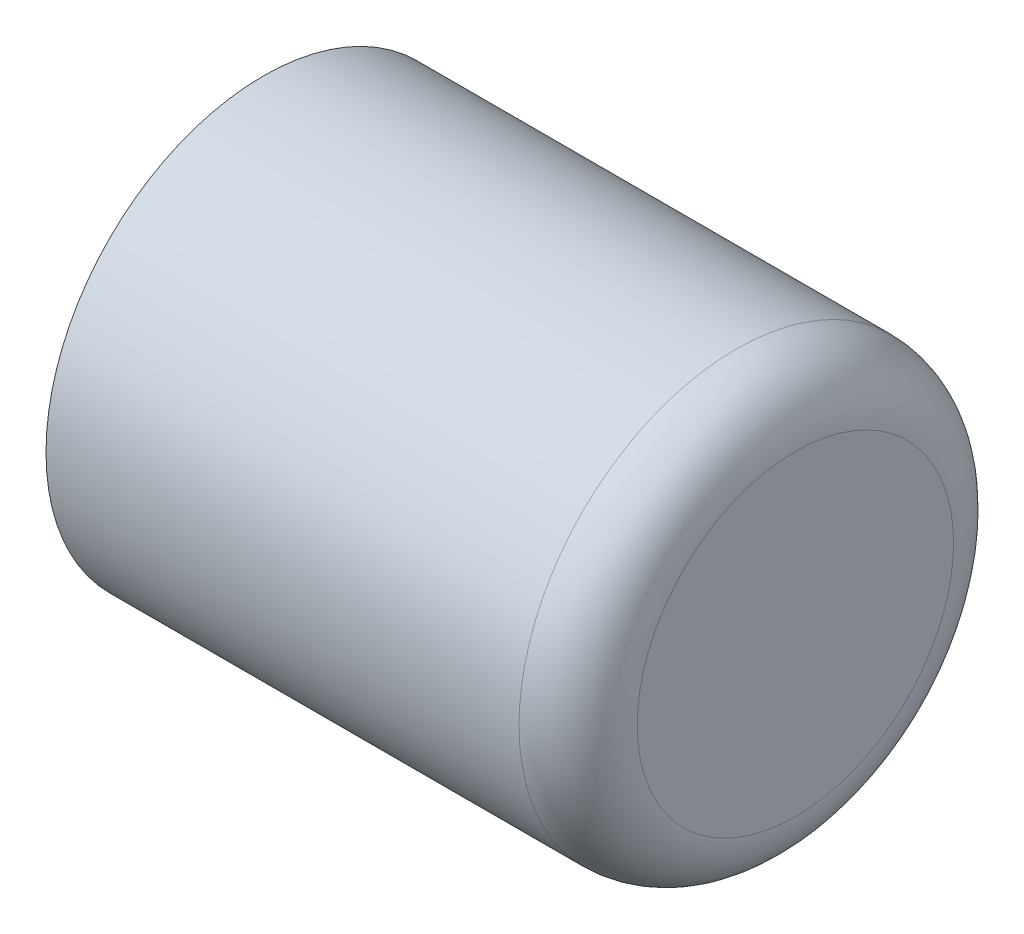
SolidWorks part; units mm, degrees
ref_plane "Front" through (0, 0, 0) normal (0, 0, 1) x (1, 0, 0)
ref_plane "Top" through (0, 0, 0) normal (0, 1, 0) x (1, 0, 0)
ref_plane "Right" through (0, 0, 0) normal (1, 0, 0) x (0, 0, -1)
sketch "Esquisse1" plane through (0, 0, 0) normal (0, 0, 1) x (1, 0, 0)
  line L0 (50, 0) -> (-50, 0) construction
  line L1 (0, 7.35) -> (-16, 7.35)
  line L2 (-16, 7.35) -> (-16, 6.15)
  line L3 (-16, 6.15) -> (0, 6.15)
  line L4 (0, -50) -> (0, 50) construction
  line L6 (0.8, 5.35) -> (0.8, 0)
  line L7 (2, 5.35) -> (2, 0)
  line L8 (2, 0) -> (0.8, 0)
  line L9 (-43.1825, 0) -> (15.7919, 0) construction
  arc A0 (0, 6.15) -> (0.8, 5.35) centre (0, 5.35) cw
  arc A1 (0, 7.35) -> (2, 5.35) centre (0, 5.35) cw
  dimension "D1" = 2
  dimension "D2" = 1.2
  dimension "D3" = 14.7
  dimension "D4" = 18
revolve "Révolution1" add sketch "Esquisse1" angle 360 about L9
